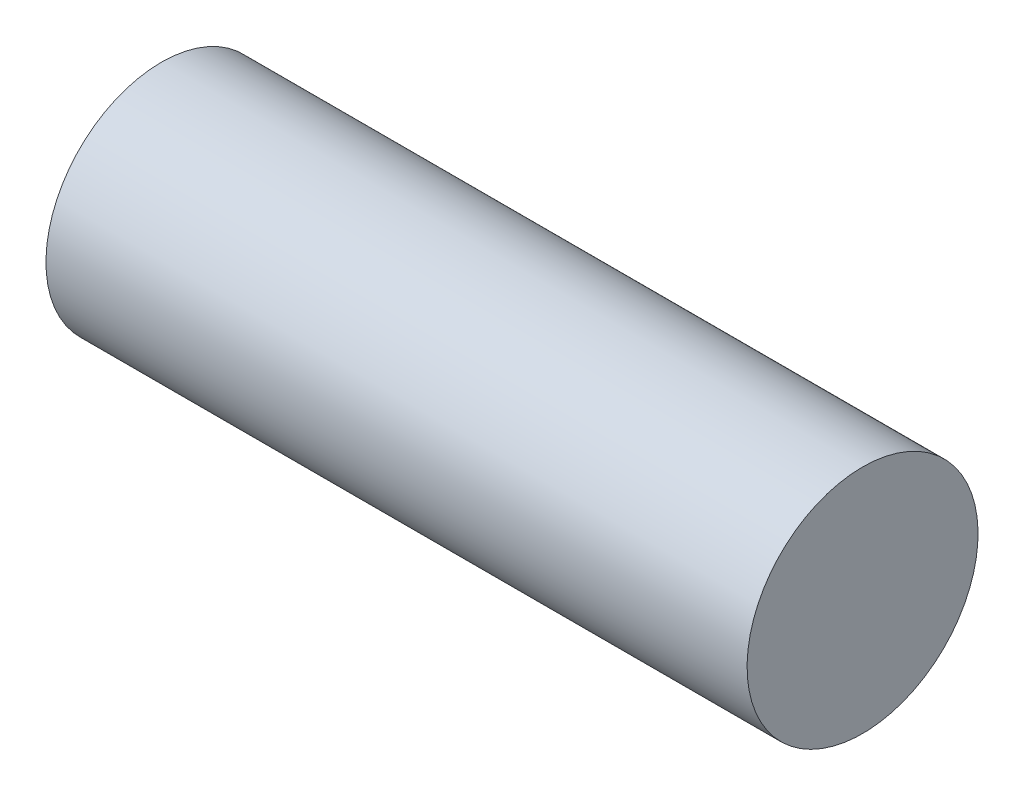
SolidWorks part; units mm, degrees
ref_plane "Front Plane" through (0, 0, 0) normal (0, 0, 1) x (1, 0, 0)
ref_plane "Top Plane" through (0, 0, 0) normal (0, 1, 0) x (1, 0, 0)
ref_plane "Right Plane" through (0, 0, 0) normal (1, 0, 0) x (0, 0, -1)
sketch "Sketch1" plane through (0, 0, 0) normal (0, 0, 1) x (1, 0, 0)
  line L2 (-255, 42) -> (0, 42)
  line L3 (0, 42) -> (0, 0)
  line L4 (0, 0) -> (-255, 0)
  line L5 (-255, 0) -> (-255, 42)
  dimension "D2" = 255
  dimension "D3" = 42
revolve "Revolve1" add sketch "Sketch1" angle 360 about L4
